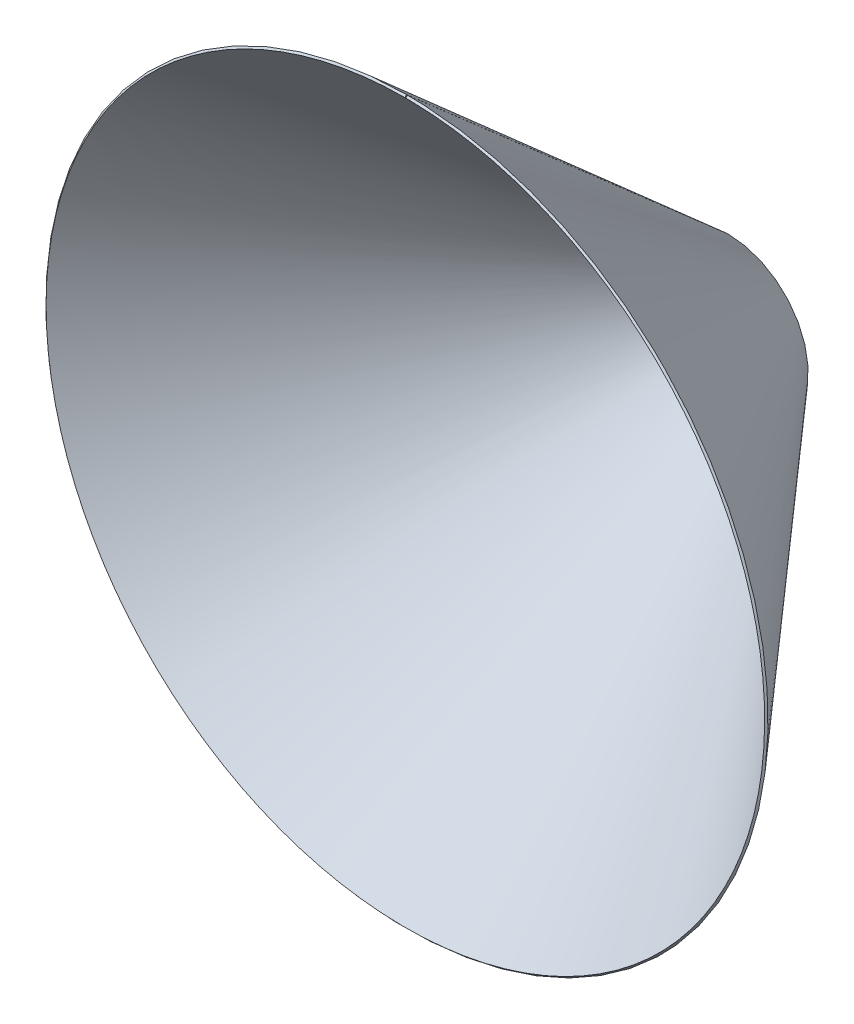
SolidWorks part; units mm, degrees
ref_plane "Plan de face" through (0, 0, 0) normal (0, 0, 1) x (1, 0, 0)
ref_plane "Plan de dessus" through (0, 0, 0) normal (0, 1, 0) x (1, 0, 0)
ref_plane "Plan de droite" through (0, 0, 0) normal (1, 0, 0) x (0, 0, -1)
sketch "Esquisse1" plane through (0, 0, 0) normal (0, 0, 1) x (1, 0, 0)
  line L0 (0, 0) -> (0, 34.1602) construction
  line L1 (0, 0) -> (-0.25, 224.9999) construction
  line L2 (-0.25, 224.9999) -> (0.25, 224.9999) construction
  line L3 (0.25, 224.9999) -> (0, 0) construction
  arc A0 (-0.25, 224.9999) -> (0.25, 224.9999) centre (0, 0) ccw
  point P3 (0, 224.9999)
  dimension "D2" = 450
  dimension "D1" = 0.5
ref_plane "Plan1" through (0, 0, -200) normal (0, 0, 1) x (1, 0, 0)
sketch "Esquisse2" plane through (0, 0, -200) normal (0, 0, 1) x (1, 0, 0)
  line L0 (0, 0) -> (-0.25, 49.9994) construction
  line L1 (-0.25, 49.9994) -> (0.25, 49.9994) construction
  line L2 (0.25, 49.9994) -> (0, 0) construction
  line L3 (0, 49.9994) -> (0, 0) construction
  arc A0 (-0.25, 49.9994) -> (0.25, 49.9994) centre (0, 0) ccw
  point P3 (0, 49.9994)
  dimension "D2" = 100
  dimension "D1" = 0.5
sheet metal parameters "Tôlerie 1" thickness 1.5 parameters "D1"=2.5
lofted bend "Plis de transition1" thickness 1.5 parameters "D1"=0, "D12"=1.5
other "Pli libre1" parameters "D1"=1000, "D4"=57.296, "D5"=1
flat pattern "Etat déplié1"
sketch "Lignes de pliage1"
sketch3d "Cube de visualisation1" [suppressed]
  line L0 (461.5981, -71.1461, 0) -> (136.2714, -669.5143, 0) construction
  line L1 (19.6993, 169.1097, 0) -> (-305.6273, -429.2585, 0) construction
  line L2 (461.5981, -71.1461, 0) -> (19.6993, 169.1097, 0) construction
  line L3 (136.2714, -669.5143, 0) -> (-305.6273, -429.2585, 0) construction
other "Dépliage-<Pli libre1>1"
